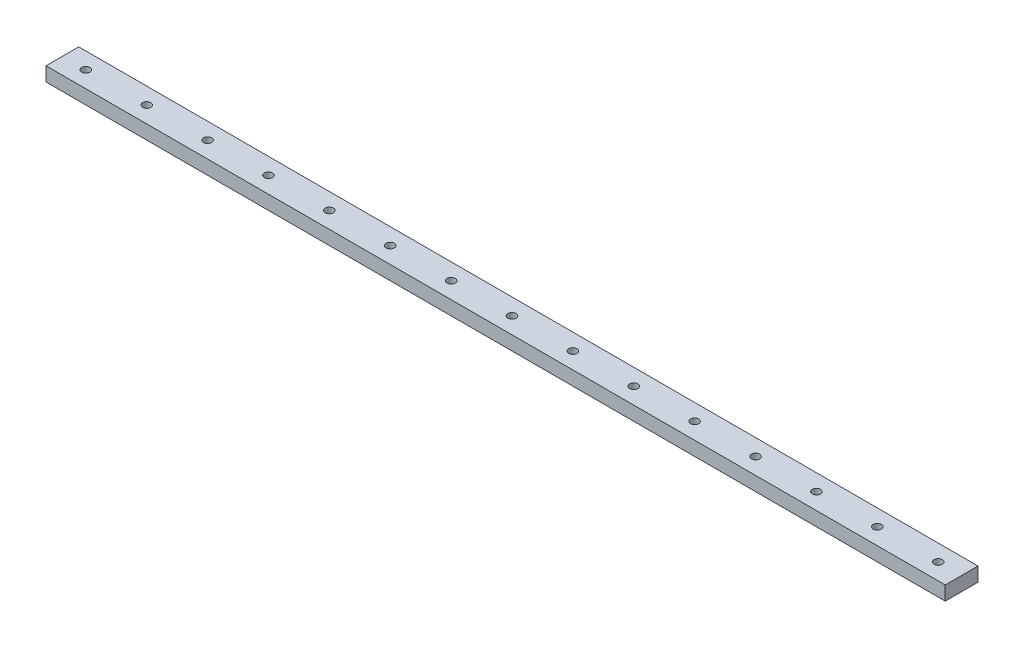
SolidWorks part; units mm, degrees
ref_plane "Front Plane" through (0, 0, 0) normal (0, 0, 1) x (1, 0, 0)
ref_plane "Top Plane" through (0, 0, 0) normal (0, 1, 0) x (1, 0, 0)
ref_plane "Right Plane" through (0, 0, 0) normal (1, 0, 0) x (0, 0, -1)
sketch "Sketch1" plane through (0, 0, 0) normal (0, 1, 0) x (1, 0, 0)
  line L1 (0, 0) -> (2438.4, 0)
  line L2 (0, 0) -> (0, 88.9)
  line L3 (0, 88.9) -> (2438.4, 88.9)
  line L4 (2438.4, 0) -> (2438.4, 88.9)
  circle A0 centre (38.1, 44.45) radius 25.4 construction
  circle A5 centre (628.65, 44.45) radius 25.4 construction
  circle A6 centre (1219.2, 44.45) radius 25.4 construction
  circle A7 centre (1809.75, 44.45) radius 25.4 construction
  circle A8 centre (2400.3, 44.45) radius 25.4 construction
  point P8 (0, 44.45)
  dimension "D3" = 50.8
  dimension "D4" = 38.1
  dimension "D6" = 38.1
  dimension "D1" = 2438.4
  dimension "D2" = 88.9
  dimension "D5" = 5
extrude "Boss-Extrude1" add sketch "Sketch1" along normal blind 38.1
sketch "Sketch2" plane through (0, 38.1, 0) normal (0, 1, 0) x (1, 0, 0)
  line L0 (0, 88.9) -> (0, 0) construction
  line L1 (63.5, 44.45) -> (0, 44.45) construction
  line L3 (2374.9, 44.45) -> (2438.4, 44.45) construction
  line L4 (2438.4, 0) -> (2438.4, 88.9) construction
  circle A0 centre (63.5, 44.45) radius 11.1125
  circle A1 centre (228.6, 44.45) radius 11.1125
  circle A2 centre (393.7, 44.45) radius 11.1125
  circle A3 centre (558.8, 44.45) radius 11.1125
  circle A4 centre (723.9, 44.45) radius 11.1125
  circle A5 centre (889, 44.45) radius 11.1125
  circle A6 centre (1054.1, 44.45) radius 11.1125
  circle A7 centre (1219.2, 44.45) radius 11.1125
  circle A8 centre (1384.3, 44.45) radius 11.1125
  circle A9 centre (1549.4, 44.45) radius 11.1125
  circle A10 centre (1714.5, 44.45) radius 11.1125
  circle A11 centre (1879.6, 44.45) radius 11.1125
  circle A12 centre (2044.7, 44.45) radius 11.1125
  circle A13 centre (2209.8, 44.45) radius 11.1125
  circle A14 centre (2374.9, 44.45) radius 11.1125
  point P6 (0, 44.45)
  dimension "D1" = 63.5
  dimension "D2" = 22.225
  dimension "D4" = 165.1
  dimension "D3" = 15
extrude "Cut-Extrude1" cut sketch "Sketch2" against normal through all
